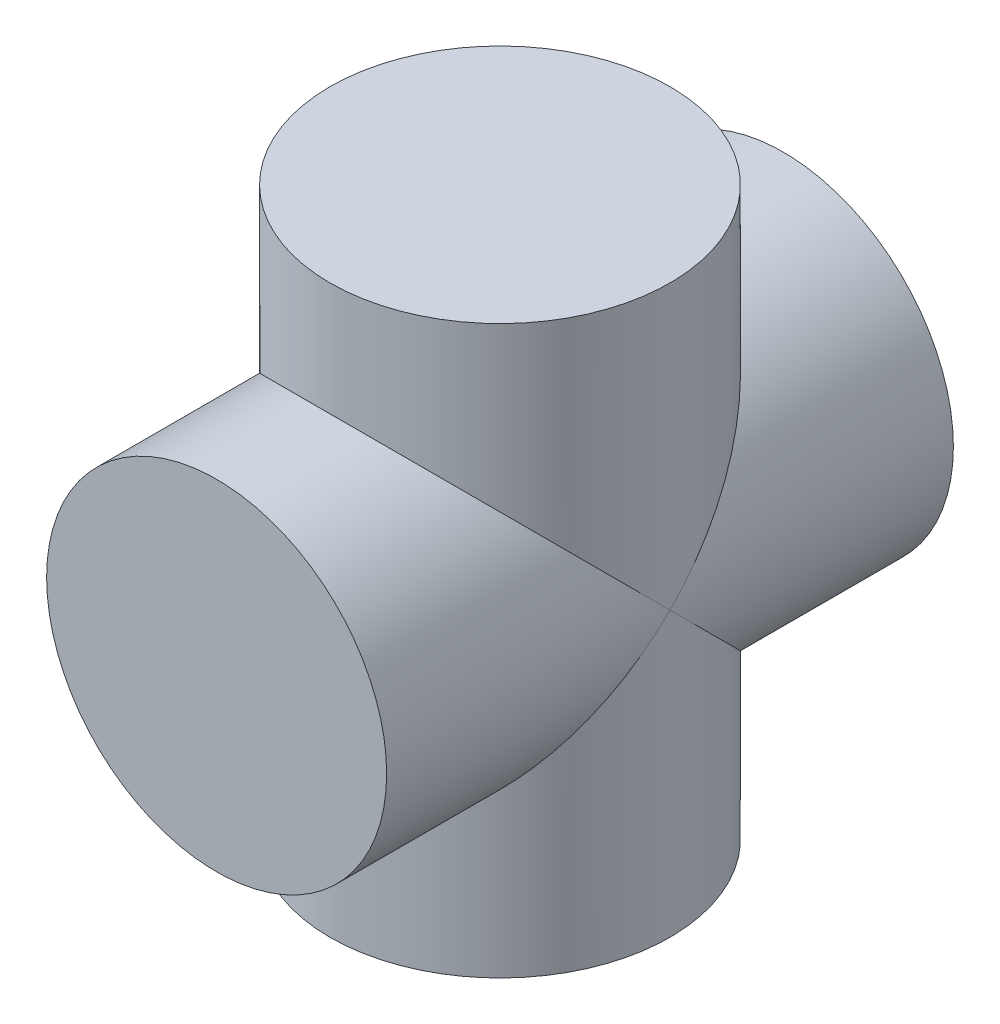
SolidWorks part; units mm, degrees
ref_plane "前视基准面" through (0, 0, 0) normal (0, 0, 1) x (1, 0, 0)
ref_plane "上视基准面" through (0, 0, 0) normal (0, 1, 0) x (1, 0, 0)
ref_plane "右视基准面" through (0, 0, 0) normal (1, 0, 0) x (0, 0, -1)
sketch "草图1" plane through (0, 0, 0) normal (0, 1, 0) x (1, 0, 0)
  circle A0 centre (0, 0) radius 6
  dimension "D1" = 12
extrude "凸台-拉伸1" add sketch "草图1" along normal blind 20
sketch "草图2" plane through (0, 0, 0) normal (0, 0, 1) x (1, 0, 0)
  line L0 (0, 18.9447) -> (0, 2.2457) construction
  line L1 (-5.0593, 10) -> (4.7286, 10) construction
  circle A0 centre (0, 10) radius 6
  dimension "D1" = 12
extrude "凸台-拉伸2" add sketch "草图2" along normal mid plane 20
